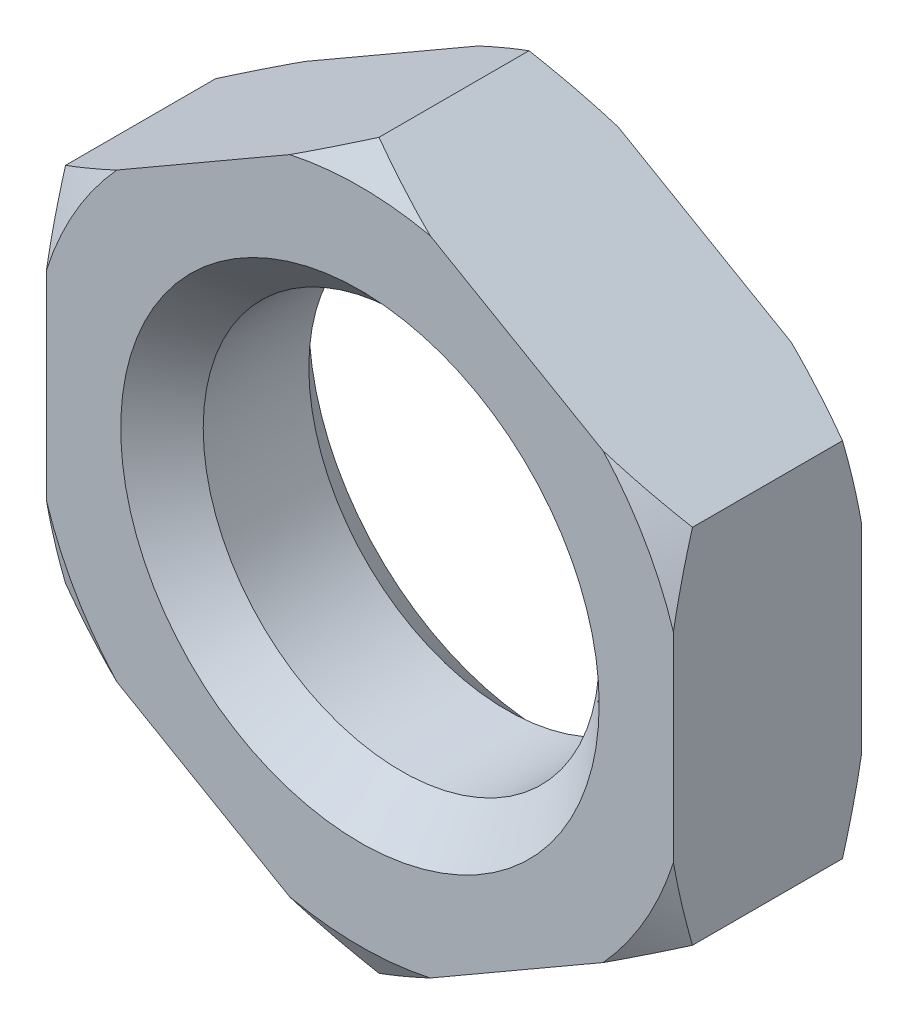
SolidWorks part; units mm, degrees
ref_plane "Front Plane" through (0, 0, 0) normal (0, 0, 1) x (1, 0, 0)
ref_plane "Top Plane" through (0, 0, 0) normal (0, 1, 0) x (1, 0, 0)
ref_plane "Right Plane" through (0, 0, 0) normal (1, 0, 0) x (0, 0, -1)
sketch "Sketch1" plane through (0, 0, 0) normal (0, 0, 1) x (1, 0, 0)
  line L1 (0, 10.9697) -> (-9.5, 5.4848)
  line L2 (-9.5, 5.4848) -> (-9.5, -5.4848)
  line L3 (-9.5, -5.4848) -> (0, -10.9697)
  line L4 (0, -10.9697) -> (9.5, -5.4848)
  line L5 (9.5, -5.4848) -> (9.5, 5.4848)
  line L6 (9.5, 5.4848) -> (0, 10.9697)
  circle A0 centre (0, 0) radius 9.5 construction
  circle A1 centre (0, 0) radius 6
  dimension "D2" = 12
  dimension "D1" = 19
extrude "Boss-Extrude1" add sketch "Sketch1" along normal mid plane 5.7
sketch "Sketch2" plane through (0, 0, 0) normal (1, 0, 0) x (0, 0, -1)
  line L0 (7.477, 0) -> (-8.5759, 0) construction
sketch "Sketch3" plane through (0, 0, 0) normal (1, 0, 0) x (0, 0, -1)
  line L0 (-2.85, 10.9697) -> (-2.85, 9.9697)
  line L1 (-2.85, 5.4848) -> (-2.85, 10.9697) construction
  line L2 (-2.85, 9.9697) -> (-2.2726, 10.9697)
  line L3 (-2.85, 10.9697) -> (2.85, 10.9697) construction
  line L4 (-2.2726, 10.9697) -> (-2.85, 10.9697)
  dimension "D1" = 1
  dimension "D2" = 30
revolve "Cut-Revolve1" cut sketch "Sketch3" angle 360 about L0
mirror "Mirror1" about plane through (0, 0, 0) normal (0, 0, 1) of "Cut-Revolve1"
chamfer "Chamfer1" distance 1.25 angle 45 2 edges at (6, 0, -2.85) (6, 0, 2.85)
